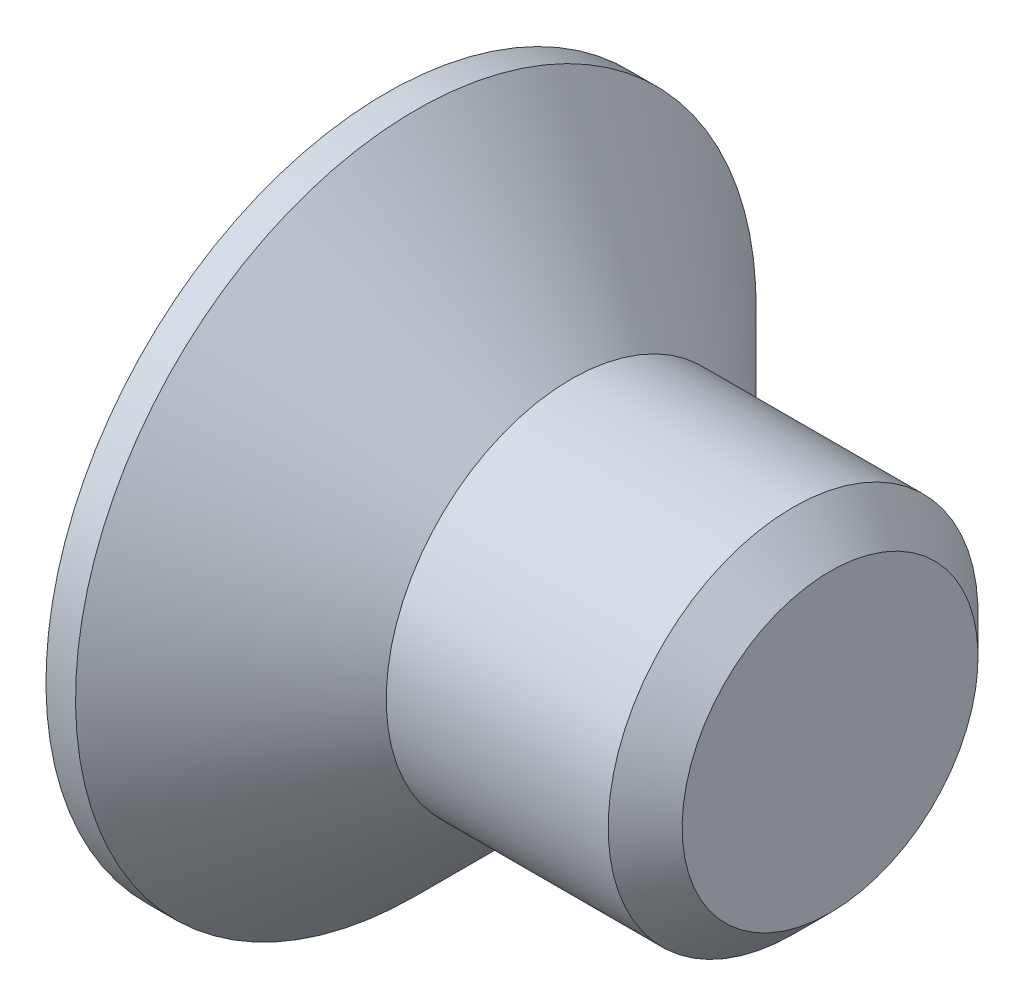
SolidWorks part; units mm, degrees
ref_plane "Front Plane" through (0, 0, 0) normal (0, 0, 1) x (1, 0, 0)
ref_plane "Top Plane" through (0, 0, 0) normal (0, 1, 0) x (1, 0, 0)
ref_plane "Right Plane" through (0, 0, 0) normal (1, 0, 0) x (0, 0, -1)
sketch "Sketch1" plane through (0, 0, 0) normal (0, 0, 1) x (1, 0, 0)
  line L1 (-2.5, 4.6) -> (-2.5, 0)
  line L2 (-2.5, 0) -> (3.5, 0)
  line L3 (3.5, 0) -> (3.5, 2.5)
  line L4 (3.5, 2.5) -> (0, 2.5)
  line L5 (-2.5, 4.6) -> (-2.1, 4.6)
  line L6 (-2.1, 4.6) -> (0, 2.5)
  dimension "D1" = 2.5
  dimension "D2" = 45
  dimension "D3" = 2.5
  dimension "D4" = 6
  dimension "D5" = 4.6
revolve "Revolve1" add sketch "Sketch1" angle 360 about L2
chamfer "Chamfer1" distance 0.5 angle 45 1 edges at (3.5, -2.5, 0)
sketch "Sketch2" plane through (-2.5, 0, 0) normal (-1, 0, 0) x (0, 0, 1)
  line L0 (-0.575, 2.3) -> (0.575, 2.3)
  line L1 (0.575, 2.3) -> (0.575, 0.575)
  line L2 (0.575, 0.575) -> (2.3, 0.575)
  line L3 (2.3, 0.575) -> (2.3, -0.575)
  line L4 (2.3, -0.575) -> (0.575, -0.575)
  line L5 (0.575, -0.575) -> (0.575, -2.3)
  line L6 (0.575, -2.3) -> (-0.575, -2.3)
  line L7 (-0.575, -2.3) -> (-0.575, -0.575)
  line L8 (-0.575, -0.575) -> (-2.3, -0.575)
  line L9 (-2.3, -0.575) -> (-2.3, 0.575)
  line L10 (-2.3, 0.575) -> (-0.575, 0.575)
  line L11 (-0.575, 0.575) -> (-0.575, 2.3)
  point P2 (0, 2.3)
  point P14 (0, -2.3)
  point P15 (2.3, 0)
  point P16 (-2.3, 0)
  point P17 (0.2443, 1.0495)
  point P18 (1.175, 0.2864)
  dimension "D1" = 4.6
  dimension "D2" = 1.15
extrude "Cut-Extrude1" cut sketch "Sketch2" against normal blind 2.1
